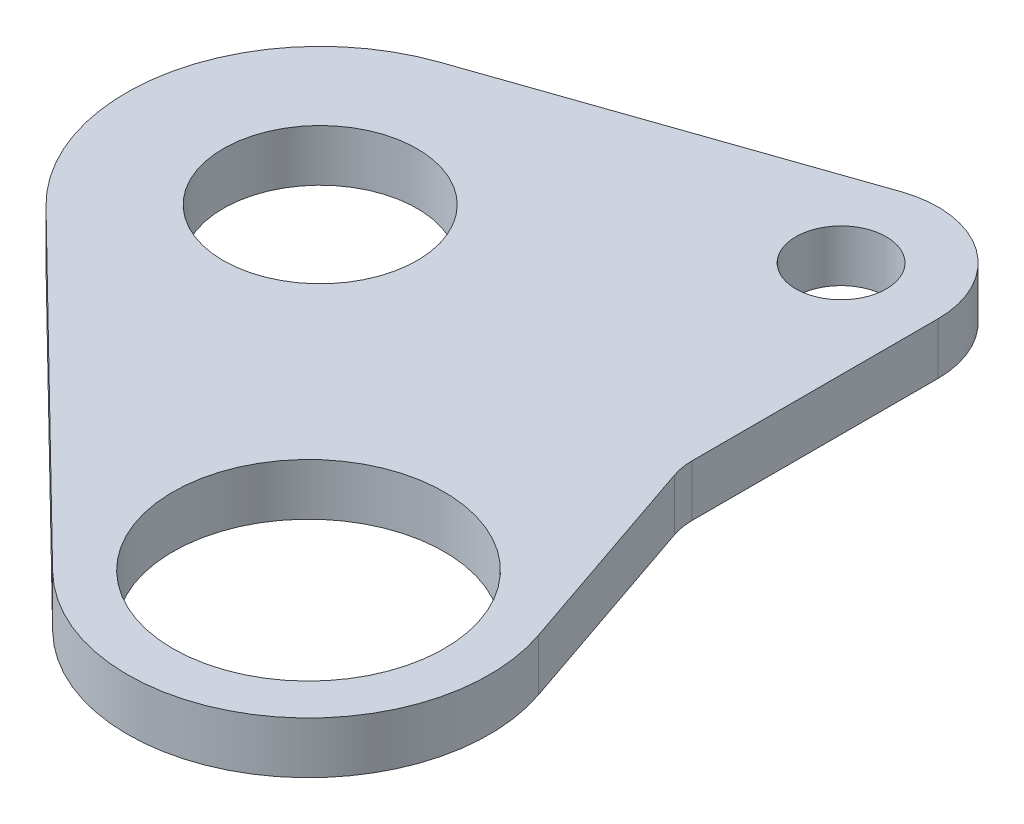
SolidWorks part; units mm, degrees
ref_plane "Plan de face" through (0, 0, 0) normal (0, 0, 1) x (1, 0, 0)
ref_plane "Plan de dessus" through (0, 0, 0) normal (0, 1, 0) x (1, 0, 0)
ref_plane "Plan de droite" through (0, 0, 0) normal (1, 0, 0) x (0, 0, -1)
sketch "Esquisse1" plane through (0, 0, 0) normal (0, 1, 0) x (1, 0, 0)
  line L0 (-57.9022, 78.2534) -> (-4.9011, 96.5767)
  line L1 (15, 82.4) -> (15, 44.3612)
  line L2 (15.5371, 41.128) -> (26.4961, 9.0529)
  line L3 (-19.5901, -20.0057) -> (-69.0894, 28.4653)
  circle A0 centre (0, 0) radius 21
  circle A1 centre (-48.1, 49.9) radius 15
  circle A2 centre (0, 82.4) radius 7
  arc A3 (-4.9011, 96.5767) -> (15, 82.4) centre (0, 82.4) cw
  arc A4 (26.4961, 9.0529) -> (-19.5901, -20.0057) centre (0, 0) cw
  arc A5 (-69.0894, 28.4653) -> (-57.9022, 78.2534) centre (-48.1, 49.9) cw
  arc A6 (15, 44.3612) -> (15.5371, 41.128) centre (25, 44.3612) ccw
  point P11 (15, 42.7)
  dimension "D1" = 30
  dimension "D2" = 42
  dimension "D3" = 14
  dimension "D4" = 15
  dimension "D5" = 28
  dimension "D6" = 30
  dimension "D12" = 10
  dimension "D7" = 49.9
  dimension "D8" = 48.1
  dimension "D9" = 48.1
  dimension "D10" = 82.4
  dimension "D11" = 42.7
extrude "Extrusion1" add sketch "Esquisse1" along normal blind 8
